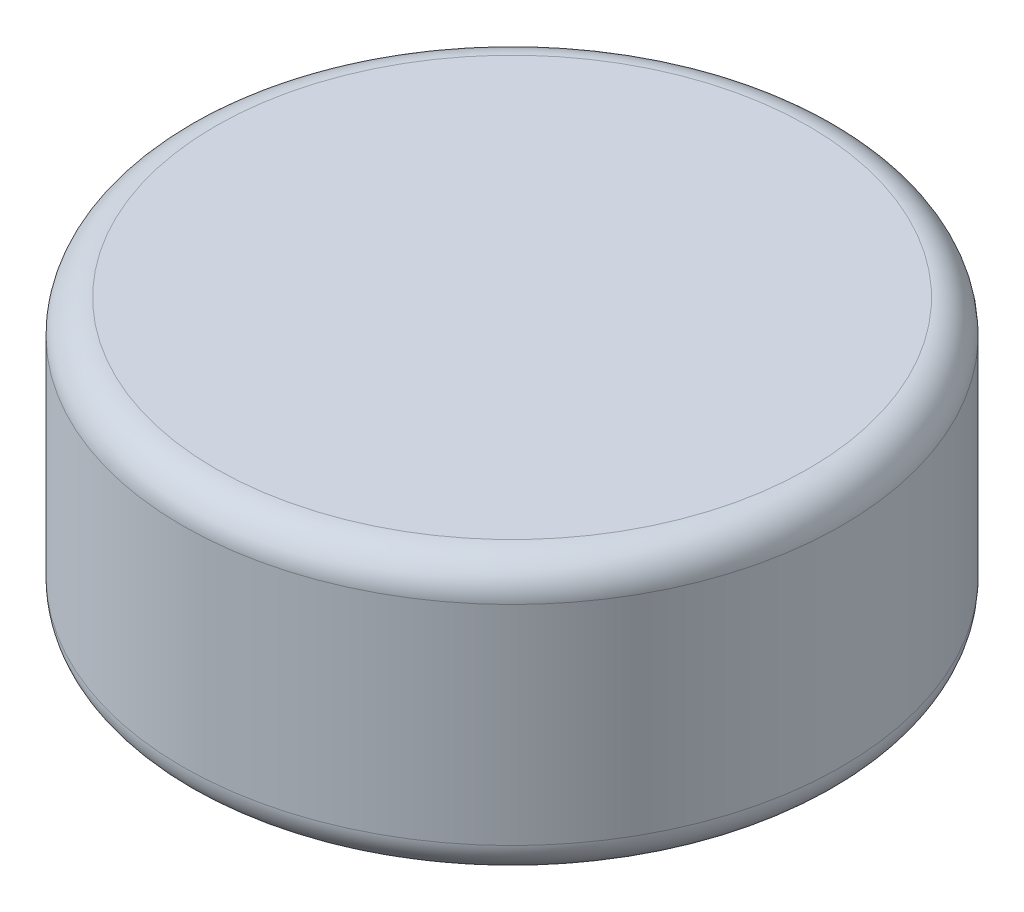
SolidWorks part; units mm, degrees
ref_plane "Front Plane" through (0, 0, 0) normal (0, 0, 1) x (1, 0, 0)
ref_plane "Top Plane" through (0, 0, 0) normal (0, 1, 0) x (1, 0, 0)
ref_plane "Right Plane" through (0, 0, 0) normal (1, 0, 0) x (0, 0, -1)
sketch "Sketch1" plane through (0, 0, 0) normal (0, 1, 0) x (1, 0, 0)
  circle A0 centre (0, 0) radius 3
  dimension "D1" = 6
extrude "Boss-Extrude1" add sketch "Sketch1" along normal blind 2.5
fillet "Fillet1" radius 0.3 2 edges at (0, 2.5, 3) (0, 0, 3)
